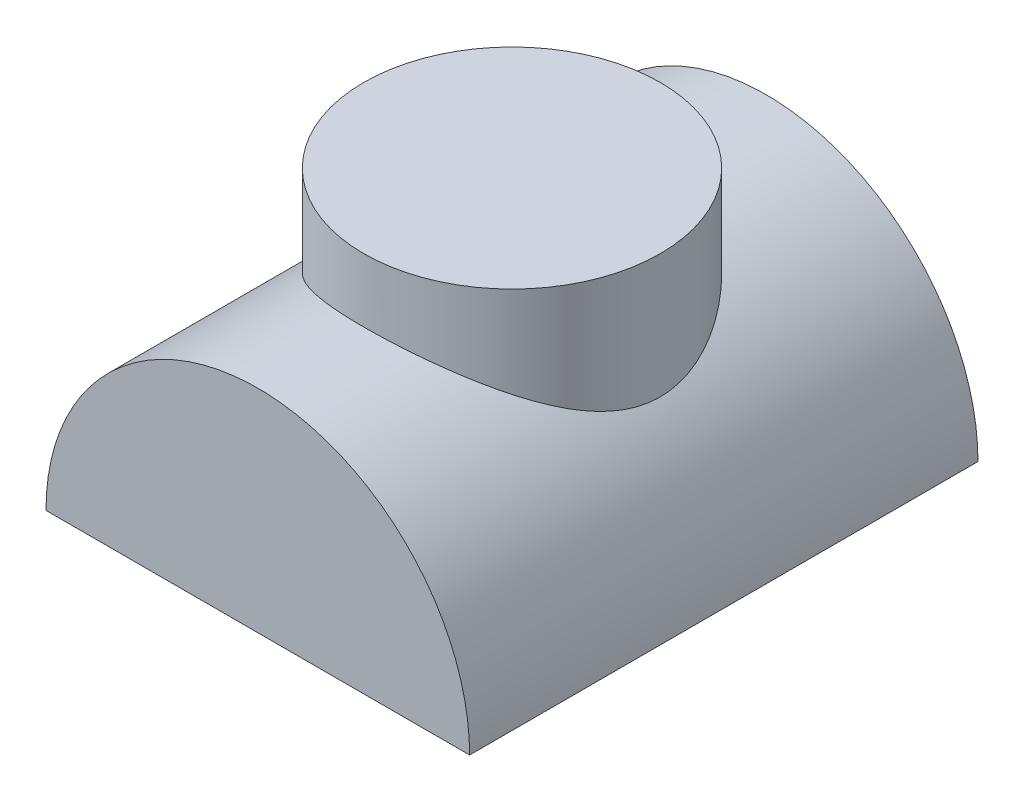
SolidWorks part; units mm, degrees
ref_plane "前视基准面" through (0, 0, 0) normal (0, 0, 1) x (1, 0, 0)
ref_plane "上视基准面" through (0, 0, 0) normal (0, 1, 0) x (1, 0, 0)
ref_plane "右视基准面" through (0, 0, 0) normal (1, 0, 0) x (0, 0, -1)
sketch "草图1" plane through (0, 0, 0) normal (0, 0, 1) x (1, 0, 0)
  line L0 (50, 0) -> (-50, 0)
  arc A0 (-50, 0) -> (50, 0) centre (0, 0) cw
  dimension "D1" = 50
extrude "拉伸1" add sketch "草图1" along normal mid plane 120
sketch "草图2" plane through (0, 0, 0) normal (0, 0, 1) x (1, 0, 0)
  line L0 (0, 0) -> (0, 67.4649) construction
  line L1 (0, 65) -> (-35, 65)
  line L2 (-35, 65) -> (-35, 35.7071)
  line L3 (0, 65) -> (0, 50)
  line L4 (0, 50) -> (0.1596, 50.2235)
  arc A0 (50, 0) -> (-50, 0) centre (0, 0) ccw construction
  arc A1 (-35, 35.7071) -> (0, 50) centre (0, 0) cw
  dimension "D1" = 35
  dimension "D2" = 15
revolve "旋转1" add sketch "草图2" angle 360 about L0
